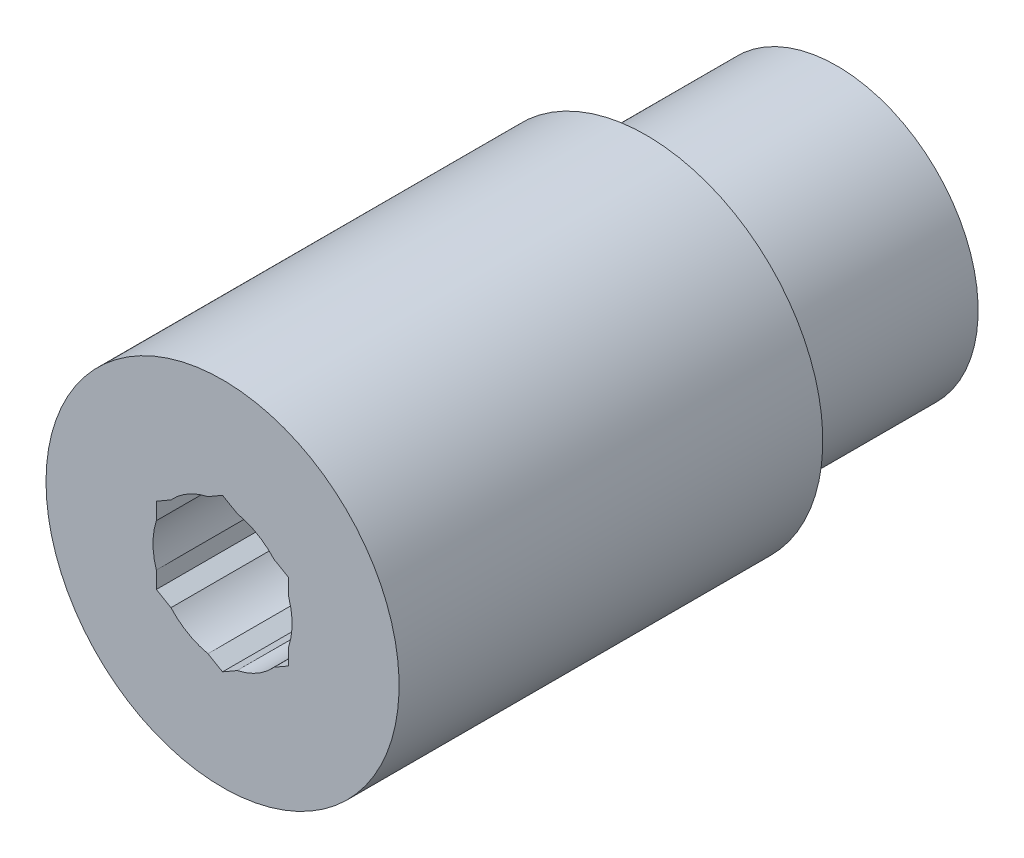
SolidWorks part; units mm, degrees
ref_plane "Front Plane" through (0, 0, 0) normal (0, 0, 1) x (1, 0, 0)
ref_plane "Top Plane" through (0, 0, 0) normal (0, 1, 0) x (1, 0, 0)
ref_plane "Right Plane" through (0, 0, 0) normal (1, 0, 0) x (0, 0, -1)
sketch "Sketch1" plane through (0, 0, 0) normal (0, 1, 0) x (1, 0, 0)
  line L0 (0, 83.4065) -> (0, -68.0147) construction
  line L1 (-2.5019, -36.7664) -> (-6.35, -36.7664)
  line L2 (-6.35, -36.7664) -> (-6.35, -21.5264)
  line L3 (-6.35, -21.5264) -> (-5.08, -21.5264)
  line L4 (-5.08, -21.5264) -> (-5.08, -14.6684)
  line L5 (-5.08, -14.6684) -> (-2.5019, -14.6684)
  line L6 (-2.5019, -14.6684) -> (-2.5019, -36.7664)
  dimension "D1" = 12.7
  dimension "D4" = 15.24
  dimension "D5" = 22.098
  dimension "D6" = 5.0038
  dimension "D7" = 10.16
revolve "Revolve1" add sketch "Sketch1" angle 360 about L0
sketch "Sketch2" plane through (0, 0, 14.6684) normal (0, 0, -1) x (-1, 0, 0)
  line L1 (0, 2.7496) -> (-2.3812, 1.3748)
  line L2 (-2.3812, 1.3748) -> (-2.3812, -1.3748)
  line L3 (-2.3812, -1.3748) -> (0, -2.7496)
  line L4 (0, -2.7496) -> (2.3812, -1.3748)
  line L5 (2.3812, -1.3748) -> (2.3812, 1.3748)
  line L6 (2.3812, 1.3748) -> (0, 2.7496)
  circle A0 centre (0, 0) radius 2.3813 construction
  dimension "D1" = 4.7625
extrude "Cut-Extrude1" cut sketch "Sketch2" against normal through all
